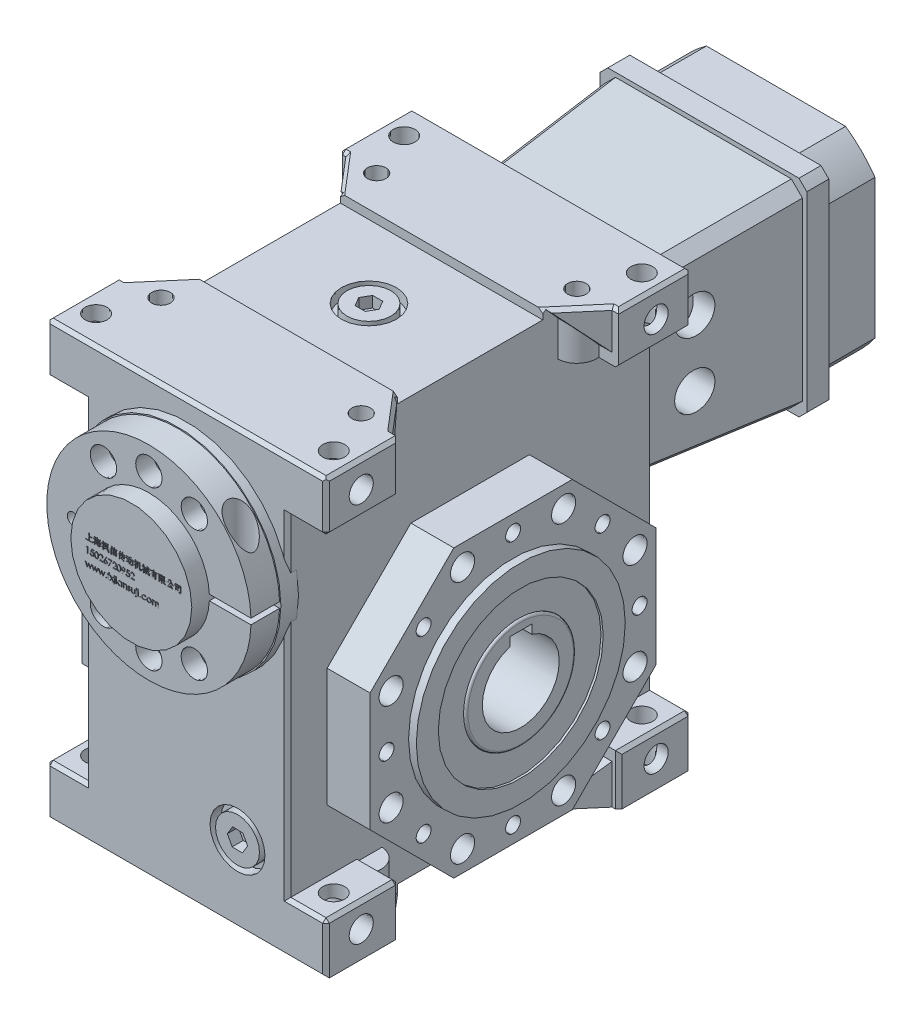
SolidWorks part; units mm, degrees
ref_plane "前视基准面" through (0, 0, 0) normal (0, 0, 1) x (1, 0, 0)
ref_plane "上视基准面" through (0, 0, 0) normal (0, 1, 0) x (1, 0, 0)
ref_plane "右视基准面" through (0, 0, 0) normal (1, 0, 0) x (0, 0, -1)
imported_body "JDLB063-CR箱体-1-solid1"
imported_body "JDLB063-CR箱体-1-solid2"
imported_body "JDLB063-CR空心轴Φ35-1-solid1"
imported_body "JDLB063-ST94输入法兰-1-solid1"
imported_body "ST90-70-90-M6伺服法兰接口-1-solid1"
imported_body "联轴器BD56-60-20-19锁紧-1-solid1"
imported_body "联轴器BD56-60-20-19锁紧-1-solid2"
imported_body "联轴器BD56-60-20-19锁紧-1-solid3"
imported_body "联轴器BD56-60-20-19锁紧-1-solid4"
imported_body "联轴器BD56-60-20-19锁紧-1-solid5"
imported_body "联轴器BD56-60-20-19锁紧-1-solid6"
imported_body "联轴器BD56-60-20-19锁紧-1-solid7"
imported_body "联轴器BD56-60-20-19锁紧-1-solid8"
imported_body "联轴器BD56-60-20-19锁紧-1-solid9"
imported_body "联轴器BD56-60-20-19锁紧-1-solid10"
imported_body "联轴器BD56-60-20-19锁紧-1-solid11"
sketch "草图1" plane through (47, 0, 0) normal (1, 0, 0) x (0, 0, -1)
  line L1 (-32.8833, 103.2216) -> (29.3974, 103.2216)
  line L2 (-32.8833, 103.2216) -> (-32.8833, 84.6971)
  line L3 (-32.8833, 84.6971) -> (29.3974, 84.6971)
  line L4 (29.3974, 103.2216) -> (29.3974, 84.6971)
extrude "切除-拉伸1" cut sketch "草图1" against normal up to surface (1 mm away)
sketch "草图2" plane through (-47, 0, 0) normal (-1, 0, 0) x (0, 0, 1)
  line L1 (-30.0362, 102.2634) -> (30.967, 102.2634)
  line L2 (-30.0362, 102.2634) -> (-30.0362, 85.3358)
  line L3 (-30.0362, 85.3358) -> (30.967, 85.3358)
  line L4 (30.967, 102.2634) -> (30.967, 85.3358)
extrude "切除-拉伸2" cut sketch "草图2" against normal up to surface (1 mm away)
sketch "草图3" plane through (0, 0, 108) normal (0, 0, 1) x (1, 0, 0)
  text T0 "上海枫信传动机械有限公司  15026720952  www.fxjiansuji.com" font "Century Gothic" height in points 10
extrude "凸台-拉伸1" add sketch "草图3" along normal blind 0.2
